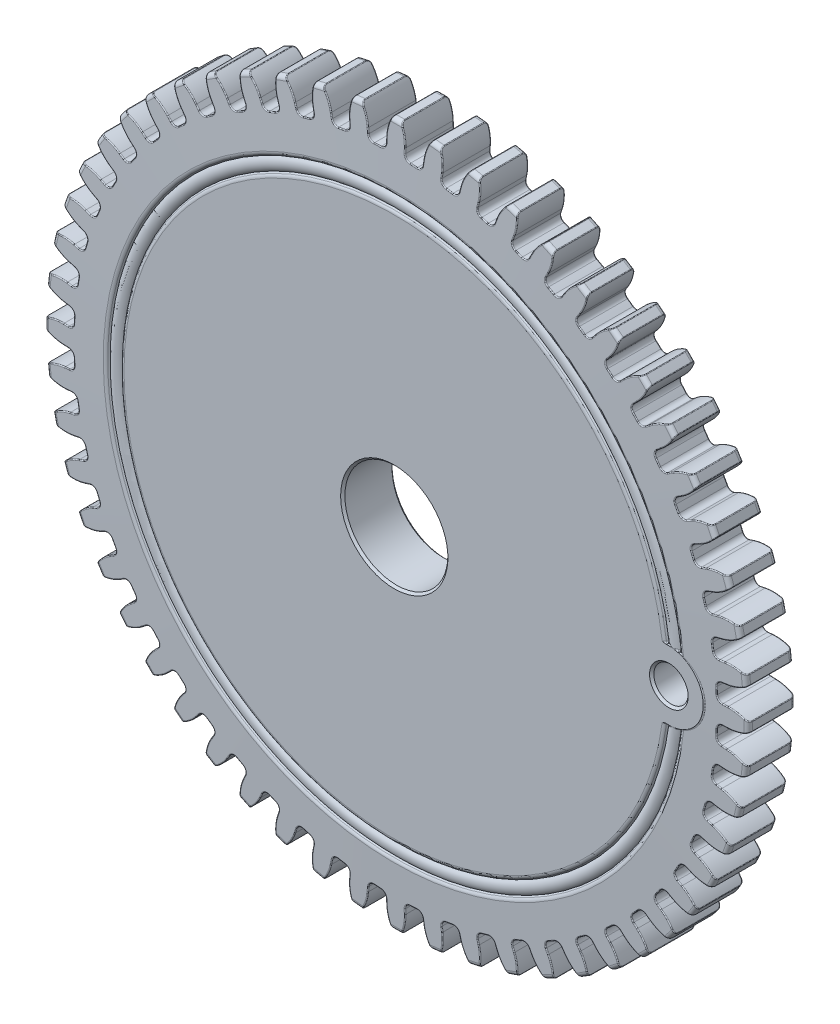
SolidWorks part; units mm, degrees
ref_plane "Спереди" through (0, 0, 0) normal (0, 0, 1) x (1, 0, 0)
ref_plane "Сверху" through (0, 0, 0) normal (0, 1, 0) x (1, 0, 0)
ref_plane "Справа" through (0, 0, 0) normal (1, 0, 0) x (0, 0, -1)
sketch "Эскиз1" plane through (0, 0, 0) normal (1, 0, 0) x (0, 0, -1)
  line L0 (0, 0) -> (8.0775, 0) construction
  line L1 (0, 0) -> (0, 41) construction
  line L2 (3, 6) -> (-3, 6)
  line L3 (-2.75, 41) -> (2.75, 41)
  line L4 (2.7071, 33.4071) -> (3, 33.7)
  line L5 (2.7071, 31.9929) -> (3, 31.7)
  line L6 (3, 6) -> (3, 31.7)
  line L7 (3, 33.7) -> (2.75, 41)
  line L8 (-3, 6) -> (-3, 31.7)
  line L9 (-2.7071, 31.9929) -> (-3, 31.7)
  line L10 (-2.7071, 33.4071) -> (-3, 33.7)
  line L11 (-3, 33.7) -> (-2.75, 41)
  arc A0 (2.7071, 31.9929) -> (2.7071, 33.4071) centre (2, 32.7) ccw
  arc A1 (-2.7071, 31.9929) -> (-2.7071, 33.4071) centre (-2, 32.7) cw
  point P9 (0, 6)
  dimension "D2" = 2
  dimension "D1" = 8.3
  dimension "D3" = 5.5
  dimension "D4" = 41
  dimension "D5" = 90
  dimension "D6" = 6
  dimension "D7" = 12
revolve "Повернуть1" add sketch "Эскиз1" angle 360 about L0
fillet "Скругление1" radius 0.5 4 edges at (41, 0, -2.75) (41, 0, 2.75) (31.7, 0, 3) (33.7, 0, 3)
chamfer "Фаска1" distance 0.25 angle 45 2 edges at (6, 0, 3) (6, 0, -3)
sketch "Эскиз2" plane through (0, 0, 0) normal (0, 0, 1) x (1, 0, 0)
  line L0 (0, 0) -> (0, 41) construction
  line L1 (-1.1, 38.6781) -> (-1.1, 38.0955)
  line L2 (1.1, 38.6781) -> (1.1, 38.0955)
  line L3 (3.2375, 38.5581) -> (3.1723, 37.9791)
  line L4 (5.4237, 38.3118) -> (5.3584, 37.7328)
  line L5 (7.5343, 37.9532) -> (7.4046, 37.3852)
  line L6 (9.6791, 37.4636) -> (9.5495, 36.8956)
  line L7 (11.7363, 36.871) -> (11.5439, 36.321)
  line L8 (13.8129, 36.1444) -> (13.6204, 35.5944)
  line L9 (15.7908, 35.3251) -> (15.538, 34.8001)
  line L10 (17.7729, 34.3705) -> (17.5201, 33.8456)
  line L11 (19.6466, 33.335) -> (19.3366, 32.8416)
  line L12 (21.5094, 32.1645) -> (21.1994, 31.6712)
  line L13 (23.2554, 30.9256) -> (22.8921, 30.4701)
  line L14 (24.9754, 29.554) -> (24.6122, 29.0984)
  line L15 (26.5718, 28.1274) -> (26.1598, 27.7154)
  line L16 (28.1274, 26.5718) -> (27.7154, 26.1598)
  line L17 (29.554, 24.9754) -> (29.0984, 24.6122)
  line L18 (30.9256, 23.2554) -> (30.4701, 22.8921)
  line L19 (32.1645, 21.5094) -> (31.6712, 21.1994)
  line L20 (33.335, 19.6466) -> (32.8416, 19.3366)
  line L21 (34.3705, 17.7729) -> (33.8456, 17.5201)
  line L22 (35.3251, 15.7908) -> (34.8001, 15.538)
  line L23 (36.1444, 13.8129) -> (35.5944, 13.6204)
  line L24 (36.871, 11.7363) -> (36.321, 11.5439)
  line L25 (37.4636, 9.6791) -> (36.8956, 9.5495)
  line L26 (37.9532, 7.5343) -> (37.3852, 7.4046)
  line L27 (38.3118, 5.4237) -> (37.7328, 5.3584)
  line L28 (38.5581, 3.2375) -> (37.9791, 3.1723)
  line L29 (38.6781, 1.1) -> (38.0955, 1.1)
  line L30 (38.6781, -1.1) -> (38.0955, -1.1)
  line L31 (38.5581, -3.2375) -> (37.9791, -3.1723)
  line L32 (38.3118, -5.4237) -> (37.7328, -5.3584)
  line L33 (37.9532, -7.5343) -> (37.3852, -7.4046)
  line L34 (37.4636, -9.6791) -> (36.8956, -9.5495)
  line L35 (36.871, -11.7363) -> (36.321, -11.5439)
  line L36 (36.1444, -13.8129) -> (35.5944, -13.6204)
  line L37 (35.3251, -15.7908) -> (34.8001, -15.538)
  line L38 (34.3705, -17.7729) -> (33.8456, -17.5201)
  line L39 (33.335, -19.6466) -> (32.8416, -19.3366)
  line L40 (32.1645, -21.5094) -> (31.6712, -21.1994)
  line L41 (30.9256, -23.2554) -> (30.4701, -22.8921)
  line L42 (29.554, -24.9754) -> (29.0984, -24.6122)
  line L43 (28.1274, -26.5718) -> (27.7154, -26.1598)
  line L44 (26.5718, -28.1274) -> (26.1598, -27.7154)
  line L45 (24.9754, -29.554) -> (24.6122, -29.0984)
  line L46 (23.2554, -30.9256) -> (22.8921, -30.4701)
  line L47 (21.5094, -32.1645) -> (21.1994, -31.6712)
  line L48 (19.6466, -33.335) -> (19.3366, -32.8416)
  line L49 (17.7729, -34.3705) -> (17.5201, -33.8456)
  line L50 (15.7908, -35.3251) -> (15.538, -34.8001)
  line L51 (13.8129, -36.1444) -> (13.6204, -35.5944)
  line L52 (11.7363, -36.871) -> (11.5439, -36.321)
  line L53 (9.6791, -37.4636) -> (9.5495, -36.8956)
  line L54 (7.5343, -37.9532) -> (7.4046, -37.3852)
  line L55 (5.4237, -38.3118) -> (5.3584, -37.7328)
  line L56 (3.2375, -38.5581) -> (3.1723, -37.9791)
  line L57 (1.1, -38.6781) -> (1.1, -38.0955)
  line L58 (-1.1, -38.6781) -> (-1.1, -38.0955)
  line L59 (-3.2375, -38.5581) -> (-3.1723, -37.9791)
  line L60 (-5.4237, -38.3118) -> (-5.3584, -37.7328)
  line L61 (-7.5343, -37.9532) -> (-7.4046, -37.3852)
  line L62 (-9.6791, -37.4636) -> (-9.5495, -36.8956)
  line L63 (-11.7363, -36.871) -> (-11.5439, -36.321)
  line L64 (-13.8129, -36.1444) -> (-13.6204, -35.5944)
  line L65 (-15.7908, -35.3251) -> (-15.538, -34.8001)
  line L66 (-17.7729, -34.3705) -> (-17.5201, -33.8456)
  line L67 (-19.6466, -33.335) -> (-19.3366, -32.8416)
  line L68 (-21.5094, -32.1645) -> (-21.1994, -31.6712)
  line L69 (-23.2554, -30.9256) -> (-22.8921, -30.4701)
  line L70 (-24.9754, -29.554) -> (-24.6122, -29.0984)
  line L71 (-26.5718, -28.1274) -> (-26.1598, -27.7154)
  line L72 (-28.1274, -26.5718) -> (-27.7154, -26.1598)
  line L73 (-29.554, -24.9754) -> (-29.0984, -24.6122)
  line L74 (-30.9256, -23.2554) -> (-30.4701, -22.8921)
  line L75 (-32.1645, -21.5094) -> (-31.6712, -21.1994)
  line L76 (-33.335, -19.6466) -> (-32.8416, -19.3366)
  line L77 (-34.3705, -17.7729) -> (-33.8456, -17.5201)
  line L78 (-35.3251, -15.7908) -> (-34.8001, -15.538)
  line L79 (-36.1444, -13.8129) -> (-35.5944, -13.6204)
  line L80 (-36.871, -11.7363) -> (-36.321, -11.5439)
  line L81 (-37.4636, -9.6791) -> (-36.8956, -9.5495)
  line L82 (-37.9532, -7.5343) -> (-37.3852, -7.4046)
  line L83 (-38.3118, -5.4237) -> (-37.7328, -5.3584)
  line L84 (-38.5581, -3.2375) -> (-37.9791, -3.1723)
  line L85 (-38.6781, -1.1) -> (-38.0955, -1.1)
  line L86 (-38.6781, 1.1) -> (-38.0955, 1.1)
  line L87 (-38.5581, 3.2375) -> (-37.9791, 3.1723)
  line L88 (-38.3118, 5.4237) -> (-37.7328, 5.3584)
  line L89 (-37.9532, 7.5343) -> (-37.3852, 7.4046)
  line L90 (-37.4636, 9.6791) -> (-36.8956, 9.5495)
  line L91 (-36.871, 11.7363) -> (-36.321, 11.5439)
  line L92 (-36.1444, 13.8129) -> (-35.5944, 13.6204)
  line L93 (-35.3251, 15.7908) -> (-34.8001, 15.538)
  line L94 (-34.3705, 17.7729) -> (-33.8456, 17.5201)
  line L95 (-33.335, 19.6466) -> (-32.8416, 19.3366)
  line L96 (-32.1645, 21.5094) -> (-31.6712, 21.1994)
  line L97 (-30.9256, 23.2554) -> (-30.4701, 22.8921)
  line L98 (-29.554, 24.9754) -> (-29.0984, 24.6122)
  line L99 (-28.1274, 26.5718) -> (-27.7154, 26.1598)
  line L100 (-26.5718, 28.1274) -> (-26.1598, 27.7154)
  line L101 (-24.9754, 29.554) -> (-24.6122, 29.0984)
  line L102 (-23.2554, 30.9256) -> (-22.8921, 30.4701)
  line L103 (-21.5094, 32.1645) -> (-21.1994, 31.6712)
  line L104 (-19.6466, 33.335) -> (-19.3366, 32.8416)
  line L105 (-17.7729, 34.3705) -> (-17.5201, 33.8456)
  line L106 (-15.7908, 35.3251) -> (-15.538, 34.8001)
  line L107 (-13.8129, 36.1444) -> (-13.6204, 35.5944)
  line L108 (-11.7363, 36.871) -> (-11.5439, 36.321)
  line L109 (-9.6791, 37.4636) -> (-9.5495, 36.8956)
  line L110 (-7.5343, 37.9532) -> (-7.4046, 37.3852)
  line L111 (-5.4237, 38.3118) -> (-5.3584, 37.7328)
  line L112 (-3.2375, 38.5581) -> (-3.1723, 37.9791)
  circle A0 centre (0, 0) radius 41 construction
  arc A1 (0.4698, 40.9973) -> (-0.4698, 40.9973) centre (0, 0) ccw
  circle A2 centre (0, 0) radius 38.5 construction
  arc A3 (-1.7061, 37.4612) -> (-2.4989, 37.4166) centre (0, 0) ccw
  arc A4 (-0.5578, 40.9426) -> (-1.1, 38.6781) centre (3.9, 38.6781) ccw
  arc A5 (0.5578, 40.9426) -> (1.1, 38.6781) centre (-3.9, 38.6781) cw
  arc A6 (1.1, 38.0955) -> (1.7061, 37.4612) centre (1.735, 38.0955) ccw
  arc A7 (-1.1, 38.0955) -> (-1.7061, 37.4612) centre (-1.735, 38.0955) cw
  arc A8 (0.5578, 40.9426) -> (0.4698, 40.9973) centre (0.4687, 40.8973) ccw
  arc A9 (-0.5578, 40.9426) -> (-0.4698, 40.9973) centre (-0.4687, 40.8973) cw
  arc A10 (5.0571, 40.6869) -> (4.1234, 40.7921) centre (0, 0) ccw
  arc A11 (4.0298, 40.7476) -> (3.2375, 38.5581) centre (8.2061, 37.9983) ccw
  arc A12 (5.1384, 40.6227) -> (5.4237, 38.3118) centre (0.4551, 38.8716) cw
  arc A13 (3.1723, 37.9791) -> (2.4989, 37.4166) centre (2.5413, 38.0502) cw
  arc A14 (5.3584, 37.7328) -> (5.8897, 37.0346) centre (5.9894, 37.6617) ccw
  arc A15 (4.0298, 40.7476) -> (4.1234, 40.7921) centre (4.1133, 40.6926) cw
  arc A16 (5.1384, 40.6227) -> (5.0571, 40.6869) centre (5.0448, 40.5877) ccw
  arc A17 (9.5808, 39.8649) -> (8.6647, 40.074) centre (0, 0) ccw
  arc A18 (8.5667, 40.0402) -> (7.5343, 37.9532) centre (12.4089, 36.8406) ccw
  arc A19 (9.6544, 39.792) -> (9.6791, 37.4636) centre (4.8045, 38.5762) cw
  arc A20 (7.4046, 37.3852) -> (6.6726, 36.9016) centre (6.7855, 37.5265) cw
  arc A21 (9.5495, 36.8956) -> (9.9992, 36.1423) centre (10.1685, 36.7543) ccw
  arc A22 (8.5667, 40.0402) -> (8.6647, 40.074) centre (8.6436, 39.9762) cw
  arc A23 (9.6544, 39.792) -> (9.5808, 39.8649) centre (9.5574, 39.7676) ccw
  arc A24 (13.984, 38.5415) -> (13.0971, 38.8518) centre (0, 0) ccw
  arc A25 (12.996, 38.8293) -> (11.7363, 36.871) centre (16.4557, 35.2196) ccw
  arc A26 (14.049, 38.4608) -> (13.8129, 36.1444) centre (9.0934, 37.7957) cw
  arc A27 (11.5439, 36.321) -> (10.7623, 35.9225) centre (10.9445, 36.5308) cw
  arc A28 (13.6204, 35.5944) -> (13.983, 34.7955) centre (14.2198, 35.3847) ccw
  arc A29 (12.996, 38.8293) -> (13.0971, 38.8518) centre (13.0652, 38.7571) cw
  arc A30 (14.049, 38.4608) -> (13.984, 38.5415) centre (13.9499, 38.4475) ccw
  arc A31 (18.2114, 36.7335) -> (17.3648, 37.1411) centre (0, 0) ccw
  arc A32 (17.2617, 37.13) -> (15.7908, 35.3251) centre (20.2956, 33.1557) ccw
  arc A33 (18.2669, 36.646) -> (17.7729, 34.3705) centre (13.268, 36.54) cw
  arc A34 (15.538, 34.8001) -> (14.7166, 34.4916) centre (14.9658, 35.0757) cw
  arc A35 (17.5201, 33.8456) -> (17.7909, 33.0111) centre (18.0922, 33.5701) ccw
  arc A36 (17.2617, 37.13) -> (17.3648, 37.1411) centre (17.3224, 37.0506) cw
  arc A37 (18.2669, 36.646) -> (18.2114, 36.7335) centre (18.1669, 36.6439) ccw
  arc A38 (22.2097, 34.4635) -> (21.4141, 34.9634) centre (0, 0) ccw
  arc A39 (21.3105, 34.9639) -> (19.6466, 33.335) centre (23.8802, 30.6748) ccw
  arc A40 (22.2551, 34.3703) -> (21.5094, 32.1645) centre (17.2758, 34.8246) cw
  arc A41 (19.3366, 32.8416) -> (18.4859, 32.627) centre (18.799, 33.1795) cw
  arc A42 (21.1994, 31.6712) -> (21.3751, 30.8116) centre (21.7371, 31.3333) ccw
  arc A43 (21.3105, 34.9639) -> (21.4141, 34.9634) centre (21.3618, 34.8781) cw
  arc A44 (22.2551, 34.3703) -> (22.2097, 34.4635) centre (22.1555, 34.3794) ccw
  arc A45 (25.9287, 31.7601) -> (25.1941, 32.3459) centre (0, 0) ccw
  arc A46 (25.0912, 32.358) -> (23.2554, 30.9256) centre (27.1646, 27.8082) ccw
  arc A47 (25.9634, 31.6624) -> (24.9754, 29.554) centre (21.0663, 32.6714) cw
  arc A48 (22.8921, 30.4701) -> (22.0228, 30.3521) centre (22.3957, 30.866) cw
  arc A49 (24.6122, 29.0984) -> (24.6905, 28.2246) centre (25.1086, 28.7025) ccw
  arc A50 (25.0912, 32.358) -> (25.1941, 32.3459) centre (25.1326, 32.267) cw
  arc A51 (25.9634, 31.6624) -> (25.9287, 31.7601) centre (25.8655, 31.6826) ccw
  arc A52 (29.3217, 28.6573) -> (28.6573, 29.3217) centre (0, 0) ccw
  arc A53 (28.5563, 29.3452) -> (26.5718, 28.1274) centre (30.1073, 24.5919) ccw
  arc A54 (29.3452, 28.5563) -> (28.1274, 26.5718) centre (24.5919, 30.1073) cw
  arc A55 (26.1598, 27.7154) -> (25.2826, 27.6954) centre (25.7108, 28.1644) cw
  arc A56 (27.7154, 26.1598) -> (27.6954, 25.2826) centre (28.1644, 25.7108) ccw
  arc A57 (28.5563, 29.3452) -> (28.6573, 29.3217) centre (28.5874, 29.2502) cw
  arc A58 (29.3452, 28.5563) -> (29.3217, 28.6573) centre (29.2502, 28.5874) ccw
  arc A59 (32.3459, 25.1941) -> (31.7601, 25.9287) centre (0, 0) ccw
  arc A60 (31.6624, 25.9634) -> (29.554, 24.9754) centre (32.6714, 21.0663) ccw
  arc A61 (32.358, 25.0912) -> (30.9256, 23.2554) centre (27.8082, 27.1646) cw
  arc A62 (29.0984, 24.6122) -> (28.2246, 24.6905) centre (28.7025, 25.1086) cw
  arc A63 (30.4701, 22.8921) -> (30.3521, 22.0228) centre (30.866, 22.3957) ccw
  arc A64 (31.6624, 25.9634) -> (31.7601, 25.9287) centre (31.6826, 25.8655) cw
  arc A65 (32.358, 25.0912) -> (32.3459, 25.1941) centre (32.267, 25.1326) ccw
  arc A66 (34.9634, 21.4141) -> (34.4635, 22.2097) centre (0, 0) ccw
  arc A67 (34.3703, 22.2551) -> (32.1645, 21.5094) centre (34.8246, 17.2758) ccw
  arc A68 (34.9639, 21.3105) -> (33.335, 19.6466) centre (30.6748, 23.8802) cw
  arc A69 (31.6712, 21.1994) -> (30.8116, 21.3751) centre (31.3333, 21.7371) cw
  arc A70 (32.8416, 19.3366) -> (32.627, 18.4859) centre (33.1795, 18.799) ccw
  arc A71 (34.3703, 22.2551) -> (34.4635, 22.2097) centre (34.3794, 22.1555) cw
  arc A72 (34.9639, 21.3105) -> (34.9634, 21.4141) centre (34.8781, 21.3618) ccw
  arc A73 (37.1411, 17.3648) -> (36.7335, 18.2114) centre (0, 0) ccw
  arc A74 (36.646, 18.2669) -> (34.3705, 17.7729) centre (36.54, 13.268) ccw
  arc A75 (37.13, 17.2617) -> (35.3251, 15.7908) centre (33.1557, 20.2956) cw
  arc A76 (33.8456, 17.5201) -> (33.0111, 17.7909) centre (33.5701, 18.0922) cw
  arc A77 (34.8001, 15.538) -> (34.4916, 14.7166) centre (35.0757, 14.9658) ccw
  arc A78 (36.646, 18.2669) -> (36.7335, 18.2114) centre (36.6439, 18.1669) cw
  arc A79 (37.13, 17.2617) -> (37.1411, 17.3648) centre (37.0506, 17.3224) ccw
  arc A80 (38.8518, 13.0971) -> (38.5415, 13.984) centre (0, 0) ccw
  arc A81 (38.4608, 14.049) -> (36.1444, 13.8129) centre (37.7957, 9.0934) ccw
  arc A82 (38.8293, 12.996) -> (36.871, 11.7363) centre (35.2196, 16.4557) cw
  arc A83 (35.5944, 13.6204) -> (34.7955, 13.983) centre (35.3847, 14.2198) cw
  arc A84 (36.321, 11.5439) -> (35.9225, 10.7623) centre (36.5308, 10.9445) ccw
  arc A85 (38.4608, 14.049) -> (38.5415, 13.984) centre (38.4475, 13.9499) cw
  arc A86 (38.8293, 12.996) -> (38.8518, 13.0971) centre (38.7571, 13.0652) ccw
  arc A87 (40.074, 8.6647) -> (39.8649, 9.5808) centre (0, 0) ccw
  arc A88 (39.792, 9.6544) -> (37.4636, 9.6791) centre (38.5762, 4.8045) ccw
  arc A89 (40.0402, 8.5667) -> (37.9532, 7.5343) centre (36.8406, 12.4089) cw
  arc A90 (36.8956, 9.5495) -> (36.1423, 9.9992) centre (36.7543, 10.1685) cw
  arc A91 (37.3852, 7.4046) -> (36.9016, 6.6726) centre (37.5265, 6.7855) ccw
  arc A92 (39.792, 9.6544) -> (39.8649, 9.5808) centre (39.7676, 9.5574) cw
  arc A93 (40.0402, 8.5667) -> (40.074, 8.6647) centre (39.9762, 8.6436) ccw
  arc A94 (40.7921, 4.1234) -> (40.6869, 5.0571) centre (0, 0) ccw
  arc A95 (40.6227, 5.1384) -> (38.3118, 5.4237) centre (38.8716, 0.4551) ccw
  arc A96 (40.7476, 4.0298) -> (38.5581, 3.2375) centre (37.9983, 8.2061) cw
  arc A97 (37.7328, 5.3584) -> (37.0346, 5.8897) centre (37.6617, 5.9894) cw
  arc A98 (37.9791, 3.1723) -> (37.4166, 2.4989) centre (38.0502, 2.5413) ccw
  arc A99 (40.6227, 5.1384) -> (40.6869, 5.0571) centre (40.5877, 5.0448) cw
  arc A100 (40.7476, 4.0298) -> (40.7921, 4.1234) centre (40.6926, 4.1133) ccw
  arc A101 (40.9973, -0.4698) -> (40.9973, 0.4698) centre (0, 0) ccw
  arc A102 (40.9426, 0.5578) -> (38.6781, 1.1) centre (38.6781, -3.9) ccw
  arc A103 (40.9426, -0.5578) -> (38.6781, -1.1) centre (38.6781, 3.9) cw
  arc A104 (38.0955, 1.1) -> (37.4612, 1.7061) centre (38.0955, 1.735) cw
  arc A105 (38.0955, -1.1) -> (37.4612, -1.7061) centre (38.0955, -1.735) ccw
  arc A106 (40.9426, 0.5578) -> (40.9973, 0.4698) centre (40.8973, 0.4687) cw
  arc A107 (40.9426, -0.5578) -> (40.9973, -0.4698) centre (40.8973, -0.4687) ccw
  arc A108 (40.6869, -5.0571) -> (40.7921, -4.1234) centre (0, 0) ccw
  arc A109 (40.7476, -4.0298) -> (38.5581, -3.2375) centre (37.9983, -8.2061) ccw
  arc A110 (40.6227, -5.1384) -> (38.3118, -5.4237) centre (38.8716, -0.4551) cw
  arc A111 (37.9791, -3.1723) -> (37.4166, -2.4989) centre (38.0502, -2.5413) cw
  arc A112 (37.7328, -5.3584) -> (37.0346, -5.8897) centre (37.6617, -5.9894) ccw
  arc A113 (40.7476, -4.0298) -> (40.7921, -4.1234) centre (40.6926, -4.1133) cw
  arc A114 (40.6227, -5.1384) -> (40.6869, -5.0571) centre (40.5877, -5.0448) ccw
  arc A115 (39.8649, -9.5808) -> (40.074, -8.6647) centre (0, 0) ccw
  arc A116 (40.0402, -8.5667) -> (37.9532, -7.5343) centre (36.8406, -12.4089) ccw
  arc A117 (39.792, -9.6544) -> (37.4636, -9.6791) centre (38.5762, -4.8045) cw
  arc A118 (37.3852, -7.4046) -> (36.9016, -6.6726) centre (37.5265, -6.7855) cw
  arc A119 (36.8956, -9.5495) -> (36.1423, -9.9992) centre (36.7543, -10.1685) ccw
  arc A120 (40.0402, -8.5667) -> (40.074, -8.6647) centre (39.9762, -8.6436) cw
  arc A121 (39.792, -9.6544) -> (39.8649, -9.5808) centre (39.7676, -9.5574) ccw
  arc A122 (38.5415, -13.984) -> (38.8518, -13.0971) centre (0, 0) ccw
  arc A123 (38.8293, -12.996) -> (36.871, -11.7363) centre (35.2196, -16.4557) ccw
  arc A124 (38.4608, -14.049) -> (36.1444, -13.8129) centre (37.7957, -9.0934) cw
  arc A125 (36.321, -11.5439) -> (35.9225, -10.7623) centre (36.5308, -10.9445) cw
  arc A126 (35.5944, -13.6204) -> (34.7955, -13.983) centre (35.3847, -14.2198) ccw
  arc A127 (38.8293, -12.996) -> (38.8518, -13.0971) centre (38.7571, -13.0652) cw
  arc A128 (38.4608, -14.049) -> (38.5415, -13.984) centre (38.4475, -13.9499) ccw
  arc A129 (36.7335, -18.2114) -> (37.1411, -17.3648) centre (0, 0) ccw
  arc A130 (37.13, -17.2617) -> (35.3251, -15.7908) centre (33.1557, -20.2956) ccw
  arc A131 (36.646, -18.2669) -> (34.3705, -17.7729) centre (36.54, -13.268) cw
  arc A132 (34.8001, -15.538) -> (34.4916, -14.7166) centre (35.0757, -14.9658) cw
  arc A133 (33.8456, -17.5201) -> (33.0111, -17.7909) centre (33.5701, -18.0922) ccw
  arc A134 (37.13, -17.2617) -> (37.1411, -17.3648) centre (37.0506, -17.3224) cw
  arc A135 (36.646, -18.2669) -> (36.7335, -18.2114) centre (36.6439, -18.1669) ccw
  arc A136 (34.4635, -22.2097) -> (34.9634, -21.4141) centre (0, 0) ccw
  arc A137 (34.9639, -21.3105) -> (33.335, -19.6466) centre (30.6748, -23.8802) ccw
  arc A138 (34.3703, -22.2551) -> (32.1645, -21.5094) centre (34.8246, -17.2758) cw
  arc A139 (32.8416, -19.3366) -> (32.627, -18.4859) centre (33.1795, -18.799) cw
  arc A140 (31.6712, -21.1994) -> (30.8116, -21.3751) centre (31.3333, -21.7371) ccw
  arc A141 (34.9639, -21.3105) -> (34.9634, -21.4141) centre (34.8781, -21.3618) cw
  arc A142 (34.3703, -22.2551) -> (34.4635, -22.2097) centre (34.3794, -22.1555) ccw
  arc A143 (31.7601, -25.9287) -> (32.3459, -25.1941) centre (0, 0) ccw
  arc A144 (32.358, -25.0912) -> (30.9256, -23.2554) centre (27.8082, -27.1646) ccw
  arc A145 (31.6624, -25.9634) -> (29.554, -24.9754) centre (32.6714, -21.0663) cw
  arc A146 (30.4701, -22.8921) -> (30.3521, -22.0228) centre (30.866, -22.3957) cw
  arc A147 (29.0984, -24.6122) -> (28.2246, -24.6905) centre (28.7025, -25.1086) ccw
  arc A148 (32.358, -25.0912) -> (32.3459, -25.1941) centre (32.267, -25.1326) cw
  arc A149 (31.6624, -25.9634) -> (31.7601, -25.9287) centre (31.6826, -25.8655) ccw
  arc A150 (28.6573, -29.3217) -> (29.3217, -28.6573) centre (0, 0) ccw
  arc A151 (29.3452, -28.5563) -> (28.1274, -26.5718) centre (24.5919, -30.1073) ccw
  arc A152 (28.5563, -29.3452) -> (26.5718, -28.1274) centre (30.1073, -24.5919) cw
  arc A153 (27.7154, -26.1598) -> (27.6954, -25.2826) centre (28.1644, -25.7108) cw
  arc A154 (26.1598, -27.7154) -> (25.2826, -27.6954) centre (25.7108, -28.1644) ccw
  arc A155 (29.3452, -28.5563) -> (29.3217, -28.6573) centre (29.2502, -28.5874) cw
  arc A156 (28.5563, -29.3452) -> (28.6573, -29.3217) centre (28.5874, -29.2502) ccw
  arc A157 (25.1941, -32.3459) -> (25.9287, -31.7601) centre (0, 0) ccw
  arc A158 (25.9634, -31.6624) -> (24.9754, -29.554) centre (21.0663, -32.6714) ccw
  arc A159 (25.0912, -32.358) -> (23.2554, -30.9256) centre (27.1646, -27.8082) cw
  arc A160 (24.6122, -29.0984) -> (24.6905, -28.2246) centre (25.1086, -28.7025) cw
  arc A161 (22.8921, -30.4701) -> (22.0228, -30.3521) centre (22.3957, -30.866) ccw
  arc A162 (25.9634, -31.6624) -> (25.9287, -31.7601) centre (25.8655, -31.6826) cw
  arc A163 (25.0912, -32.358) -> (25.1941, -32.3459) centre (25.1326, -32.267) ccw
  arc A164 (21.4141, -34.9634) -> (22.2097, -34.4635) centre (0, 0) ccw
  arc A165 (22.2551, -34.3703) -> (21.5094, -32.1645) centre (17.2758, -34.8246) ccw
  arc A166 (21.3105, -34.9639) -> (19.6466, -33.335) centre (23.8802, -30.6748) cw
  arc A167 (21.1994, -31.6712) -> (21.3751, -30.8116) centre (21.7371, -31.3333) cw
  arc A168 (19.3366, -32.8416) -> (18.4859, -32.627) centre (18.799, -33.1795) ccw
  arc A169 (22.2551, -34.3703) -> (22.2097, -34.4635) centre (22.1555, -34.3794) cw
  arc A170 (21.3105, -34.9639) -> (21.4141, -34.9634) centre (21.3618, -34.8781) ccw
  arc A171 (17.3648, -37.1411) -> (18.2114, -36.7335) centre (0, 0) ccw
  arc A172 (18.2669, -36.646) -> (17.7729, -34.3705) centre (13.268, -36.54) ccw
  arc A173 (17.2617, -37.13) -> (15.7908, -35.3251) centre (20.2956, -33.1557) cw
  arc A174 (17.5201, -33.8456) -> (17.7909, -33.0111) centre (18.0922, -33.5701) cw
  arc A175 (15.538, -34.8001) -> (14.7166, -34.4916) centre (14.9658, -35.0757) ccw
  arc A176 (18.2669, -36.646) -> (18.2114, -36.7335) centre (18.1669, -36.6439) cw
  arc A177 (17.2617, -37.13) -> (17.3648, -37.1411) centre (17.3224, -37.0506) ccw
  arc A178 (13.0971, -38.8518) -> (13.984, -38.5415) centre (0, 0) ccw
  arc A179 (14.049, -38.4608) -> (13.8129, -36.1444) centre (9.0934, -37.7957) ccw
  arc A180 (12.996, -38.8293) -> (11.7363, -36.871) centre (16.4557, -35.2196) cw
  arc A181 (13.6204, -35.5944) -> (13.983, -34.7955) centre (14.2198, -35.3847) cw
  arc A182 (11.5439, -36.321) -> (10.7623, -35.9225) centre (10.9445, -36.5308) ccw
  arc A183 (14.049, -38.4608) -> (13.984, -38.5415) centre (13.9499, -38.4475) cw
  arc A184 (12.996, -38.8293) -> (13.0971, -38.8518) centre (13.0652, -38.7571) ccw
  arc A185 (8.6647, -40.074) -> (9.5808, -39.8649) centre (0, 0) ccw
  arc A186 (9.6544, -39.792) -> (9.6791, -37.4636) centre (4.8045, -38.5762) ccw
  arc A187 (8.5667, -40.0402) -> (7.5343, -37.9532) centre (12.4089, -36.8406) cw
  arc A188 (9.5495, -36.8956) -> (9.9992, -36.1423) centre (10.1685, -36.7543) cw
  arc A189 (7.4046, -37.3852) -> (6.6726, -36.9016) centre (6.7855, -37.5265) ccw
  arc A190 (9.6544, -39.792) -> (9.5808, -39.8649) centre (9.5574, -39.7676) cw
  arc A191 (8.5667, -40.0402) -> (8.6647, -40.074) centre (8.6436, -39.9762) ccw
  arc A192 (4.1234, -40.7921) -> (5.0571, -40.6869) centre (0, 0) ccw
  arc A193 (5.1384, -40.6227) -> (5.4237, -38.3118) centre (0.4551, -38.8716) ccw
  arc A194 (4.0298, -40.7476) -> (3.2375, -38.5581) centre (8.2061, -37.9983) cw
  arc A195 (5.3584, -37.7328) -> (5.8897, -37.0346) centre (5.9894, -37.6617) cw
  arc A196 (3.1723, -37.9791) -> (2.4989, -37.4166) centre (2.5413, -38.0502) ccw
  arc A197 (5.1384, -40.6227) -> (5.0571, -40.6869) centre (5.0448, -40.5877) cw
  arc A198 (4.0298, -40.7476) -> (4.1234, -40.7921) centre (4.1133, -40.6926) ccw
  arc A199 (-0.4698, -40.9973) -> (0.4698, -40.9973) centre (0, 0) ccw
  arc A200 (0.5578, -40.9426) -> (1.1, -38.6781) centre (-3.9, -38.6781) ccw
  arc A201 (-0.5578, -40.9426) -> (-1.1, -38.6781) centre (3.9, -38.6781) cw
  arc A202 (1.1, -38.0955) -> (1.7061, -37.4612) centre (1.735, -38.0955) cw
  arc A203 (-1.1, -38.0955) -> (-1.7061, -37.4612) centre (-1.735, -38.0955) ccw
  arc A204 (0.5578, -40.9426) -> (0.4698, -40.9973) centre (0.4687, -40.8973) cw
  arc A205 (-0.5578, -40.9426) -> (-0.4698, -40.9973) centre (-0.4687, -40.8973) ccw
  arc A206 (-5.0571, -40.6869) -> (-4.1234, -40.7921) centre (0, 0) ccw
  arc A207 (-4.0298, -40.7476) -> (-3.2375, -38.5581) centre (-8.2061, -37.9983) ccw
  arc A208 (-5.1384, -40.6227) -> (-5.4237, -38.3118) centre (-0.4551, -38.8716) cw
  arc A209 (-3.1723, -37.9791) -> (-2.4989, -37.4166) centre (-2.5413, -38.0502) cw
  arc A210 (-5.3584, -37.7328) -> (-5.8897, -37.0346) centre (-5.9894, -37.6617) ccw
  arc A211 (-4.0298, -40.7476) -> (-4.1234, -40.7921) centre (-4.1133, -40.6926) cw
  arc A212 (-5.1384, -40.6227) -> (-5.0571, -40.6869) centre (-5.0448, -40.5877) ccw
  arc A213 (-9.5808, -39.8649) -> (-8.6647, -40.074) centre (0, 0) ccw
  arc A214 (-8.5667, -40.0402) -> (-7.5343, -37.9532) centre (-12.4089, -36.8406) ccw
  arc A215 (-9.6544, -39.792) -> (-9.6791, -37.4636) centre (-4.8045, -38.5762) cw
  arc A216 (-7.4046, -37.3852) -> (-6.6726, -36.9016) centre (-6.7855, -37.5265) cw
  arc A217 (-9.5495, -36.8956) -> (-9.9992, -36.1423) centre (-10.1685, -36.7543) ccw
  arc A218 (-8.5667, -40.0402) -> (-8.6647, -40.074) centre (-8.6436, -39.9762) cw
  arc A219 (-9.6544, -39.792) -> (-9.5808, -39.8649) centre (-9.5574, -39.7676) ccw
  arc A220 (-13.984, -38.5415) -> (-13.0971, -38.8518) centre (0, 0) ccw
  arc A221 (-12.996, -38.8293) -> (-11.7363, -36.871) centre (-16.4557, -35.2196) ccw
  arc A222 (-14.049, -38.4608) -> (-13.8129, -36.1444) centre (-9.0934, -37.7957) cw
  arc A223 (-11.5439, -36.321) -> (-10.7623, -35.9225) centre (-10.9445, -36.5308) cw
  arc A224 (-13.6204, -35.5944) -> (-13.983, -34.7955) centre (-14.2198, -35.3847) ccw
  arc A225 (-12.996, -38.8293) -> (-13.0971, -38.8518) centre (-13.0652, -38.7571) cw
  arc A226 (-14.049, -38.4608) -> (-13.984, -38.5415) centre (-13.9499, -38.4475) ccw
  arc A227 (-18.2114, -36.7335) -> (-17.3648, -37.1411) centre (0, 0) ccw
  arc A228 (-17.2617, -37.13) -> (-15.7908, -35.3251) centre (-20.2956, -33.1557) ccw
  arc A229 (-18.2669, -36.646) -> (-17.7729, -34.3705) centre (-13.268, -36.54) cw
  arc A230 (-15.538, -34.8001) -> (-14.7166, -34.4916) centre (-14.9658, -35.0757) cw
  arc A231 (-17.5201, -33.8456) -> (-17.7909, -33.0111) centre (-18.0922, -33.5701) ccw
  arc A232 (-17.2617, -37.13) -> (-17.3648, -37.1411) centre (-17.3224, -37.0506) cw
  arc A233 (-18.2669, -36.646) -> (-18.2114, -36.7335) centre (-18.1669, -36.6439) ccw
  arc A234 (-22.2097, -34.4635) -> (-21.4141, -34.9634) centre (0, 0) ccw
  arc A235 (-21.3105, -34.9639) -> (-19.6466, -33.335) centre (-23.8802, -30.6748) ccw
  arc A236 (-22.2551, -34.3703) -> (-21.5094, -32.1645) centre (-17.2758, -34.8246) cw
  arc A237 (-19.3366, -32.8416) -> (-18.4859, -32.627) centre (-18.799, -33.1795) cw
  arc A238 (-21.1994, -31.6712) -> (-21.3751, -30.8116) centre (-21.7371, -31.3333) ccw
  arc A239 (-21.3105, -34.9639) -> (-21.4141, -34.9634) centre (-21.3618, -34.8781) cw
  arc A240 (-22.2551, -34.3703) -> (-22.2097, -34.4635) centre (-22.1555, -34.3794) ccw
  arc A241 (-25.9287, -31.7601) -> (-25.1941, -32.3459) centre (0, 0) ccw
  arc A242 (-25.0912, -32.358) -> (-23.2554, -30.9256) centre (-27.1646, -27.8082) ccw
  arc A243 (-25.9634, -31.6624) -> (-24.9754, -29.554) centre (-21.0663, -32.6714) cw
  arc A244 (-22.8921, -30.4701) -> (-22.0228, -30.3521) centre (-22.3957, -30.866) cw
  arc A245 (-24.6122, -29.0984) -> (-24.6905, -28.2246) centre (-25.1086, -28.7025) ccw
  arc A246 (-25.0912, -32.358) -> (-25.1941, -32.3459) centre (-25.1326, -32.267) cw
  arc A247 (-25.9634, -31.6624) -> (-25.9287, -31.7601) centre (-25.8655, -31.6826) ccw
  arc A248 (-29.3217, -28.6573) -> (-28.6573, -29.3217) centre (0, 0) ccw
  arc A249 (-28.5563, -29.3452) -> (-26.5718, -28.1274) centre (-30.1073, -24.5919) ccw
  arc A250 (-29.3452, -28.5563) -> (-28.1274, -26.5718) centre (-24.5919, -30.1073) cw
  arc A251 (-26.1598, -27.7154) -> (-25.2826, -27.6954) centre (-25.7108, -28.1644) cw
  arc A252 (-27.7154, -26.1598) -> (-27.6954, -25.2826) centre (-28.1644, -25.7108) ccw
  arc A253 (-28.5563, -29.3452) -> (-28.6573, -29.3217) centre (-28.5874, -29.2502) cw
  arc A254 (-29.3452, -28.5563) -> (-29.3217, -28.6573) centre (-29.2502, -28.5874) ccw
  arc A255 (-32.3459, -25.1941) -> (-31.7601, -25.9287) centre (0, 0) ccw
  arc A256 (-31.6624, -25.9634) -> (-29.554, -24.9754) centre (-32.6714, -21.0663) ccw
  arc A257 (-32.358, -25.0912) -> (-30.9256, -23.2554) centre (-27.8082, -27.1646) cw
  arc A258 (-29.0984, -24.6122) -> (-28.2246, -24.6905) centre (-28.7025, -25.1086) cw
  arc A259 (-30.4701, -22.8921) -> (-30.3521, -22.0228) centre (-30.866, -22.3957) ccw
  arc A260 (-31.6624, -25.9634) -> (-31.7601, -25.9287) centre (-31.6826, -25.8655) cw
  arc A261 (-32.358, -25.0912) -> (-32.3459, -25.1941) centre (-32.267, -25.1326) ccw
  arc A262 (-34.9634, -21.4141) -> (-34.4635, -22.2097) centre (0, 0) ccw
  arc A263 (-34.3703, -22.2551) -> (-32.1645, -21.5094) centre (-34.8246, -17.2758) ccw
  arc A264 (-34.9639, -21.3105) -> (-33.335, -19.6466) centre (-30.6748, -23.8802) cw
  arc A265 (-31.6712, -21.1994) -> (-30.8116, -21.3751) centre (-31.3333, -21.7371) cw
  arc A266 (-32.8416, -19.3366) -> (-32.627, -18.4859) centre (-33.1795, -18.799) ccw
  arc A267 (-34.3703, -22.2551) -> (-34.4635, -22.2097) centre (-34.3794, -22.1555) cw
  arc A268 (-34.9639, -21.3105) -> (-34.9634, -21.4141) centre (-34.8781, -21.3618) ccw
  arc A269 (-37.1411, -17.3648) -> (-36.7335, -18.2114) centre (0, 0) ccw
  arc A270 (-36.646, -18.2669) -> (-34.3705, -17.7729) centre (-36.54, -13.268) ccw
  arc A271 (-37.13, -17.2617) -> (-35.3251, -15.7908) centre (-33.1557, -20.2956) cw
  arc A272 (-33.8456, -17.5201) -> (-33.0111, -17.7909) centre (-33.5701, -18.0922) cw
  arc A273 (-34.8001, -15.538) -> (-34.4916, -14.7166) centre (-35.0757, -14.9658) ccw
  arc A274 (-36.646, -18.2669) -> (-36.7335, -18.2114) centre (-36.6439, -18.1669) cw
  arc A275 (-37.13, -17.2617) -> (-37.1411, -17.3648) centre (-37.0506, -17.3224) ccw
  arc A276 (-38.8518, -13.0971) -> (-38.5415, -13.984) centre (0, 0) ccw
  arc A277 (-38.4608, -14.049) -> (-36.1444, -13.8129) centre (-37.7957, -9.0934) ccw
  arc A278 (-38.8293, -12.996) -> (-36.871, -11.7363) centre (-35.2196, -16.4557) cw
  arc A279 (-35.5944, -13.6204) -> (-34.7955, -13.983) centre (-35.3847, -14.2198) cw
  arc A280 (-36.321, -11.5439) -> (-35.9225, -10.7623) centre (-36.5308, -10.9445) ccw
  arc A281 (-38.4608, -14.049) -> (-38.5415, -13.984) centre (-38.4475, -13.9499) cw
  arc A282 (-38.8293, -12.996) -> (-38.8518, -13.0971) centre (-38.7571, -13.0652) ccw
  arc A283 (-40.074, -8.6647) -> (-39.8649, -9.5808) centre (0, 0) ccw
  arc A284 (-39.792, -9.6544) -> (-37.4636, -9.6791) centre (-38.5762, -4.8045) ccw
  arc A285 (-40.0402, -8.5667) -> (-37.9532, -7.5343) centre (-36.8406, -12.4089) cw
  arc A286 (-36.8956, -9.5495) -> (-36.1423, -9.9992) centre (-36.7543, -10.1685) cw
  arc A287 (-37.3852, -7.4046) -> (-36.9016, -6.6726) centre (-37.5265, -6.7855) ccw
  arc A288 (-39.792, -9.6544) -> (-39.8649, -9.5808) centre (-39.7676, -9.5574) cw
  arc A289 (-40.0402, -8.5667) -> (-40.074, -8.6647) centre (-39.9762, -8.6436) ccw
  arc A290 (-40.7921, -4.1234) -> (-40.6869, -5.0571) centre (0, 0) ccw
  arc A291 (-40.6227, -5.1384) -> (-38.3118, -5.4237) centre (-38.8716, -0.4551) ccw
  arc A292 (-40.7476, -4.0298) -> (-38.5581, -3.2375) centre (-37.9983, -8.2061) cw
  arc A293 (-37.7328, -5.3584) -> (-37.0346, -5.8897) centre (-37.6617, -5.9894) cw
  arc A294 (-37.9791, -3.1723) -> (-37.4166, -2.4989) centre (-38.0502, -2.5413) ccw
  arc A295 (-40.6227, -5.1384) -> (-40.6869, -5.0571) centre (-40.5877, -5.0448) cw
  arc A296 (-40.7476, -4.0298) -> (-40.7921, -4.1234) centre (-40.6926, -4.1133) ccw
  arc A297 (-40.9973, 0.4698) -> (-40.9973, -0.4698) centre (0, 0) ccw
  arc A298 (-40.9426, -0.5578) -> (-38.6781, -1.1) centre (-38.6781, 3.9) ccw
  arc A299 (-40.9426, 0.5578) -> (-38.6781, 1.1) centre (-38.6781, -3.9) cw
  arc A300 (-38.0955, -1.1) -> (-37.4612, -1.7061) centre (-38.0955, -1.735) cw
  arc A301 (-38.0955, 1.1) -> (-37.4612, 1.7061) centre (-38.0955, 1.735) ccw
  arc A302 (-40.9426, -0.5578) -> (-40.9973, -0.4698) centre (-40.8973, -0.4687) cw
  arc A303 (-40.9426, 0.5578) -> (-40.9973, 0.4698) centre (-40.8973, 0.4687) ccw
  arc A304 (-40.6869, 5.0571) -> (-40.7921, 4.1234) centre (0, 0) ccw
  arc A305 (-40.7476, 4.0298) -> (-38.5581, 3.2375) centre (-37.9983, 8.2061) ccw
  arc A306 (-40.6227, 5.1384) -> (-38.3118, 5.4237) centre (-38.8716, 0.4551) cw
  arc A307 (-37.9791, 3.1723) -> (-37.4166, 2.4989) centre (-38.0502, 2.5413) cw
  arc A308 (-37.7328, 5.3584) -> (-37.0346, 5.8897) centre (-37.6617, 5.9894) ccw
  arc A309 (-40.7476, 4.0298) -> (-40.7921, 4.1234) centre (-40.6926, 4.1133) cw
  arc A310 (-40.6227, 5.1384) -> (-40.6869, 5.0571) centre (-40.5877, 5.0448) ccw
  arc A311 (-39.8649, 9.5808) -> (-40.074, 8.6647) centre (0, 0) ccw
  arc A312 (-40.0402, 8.5667) -> (-37.9532, 7.5343) centre (-36.8406, 12.4089) ccw
  arc A313 (-39.792, 9.6544) -> (-37.4636, 9.6791) centre (-38.5762, 4.8045) cw
  arc A314 (-37.3852, 7.4046) -> (-36.9016, 6.6726) centre (-37.5265, 6.7855) cw
  arc A315 (-36.8956, 9.5495) -> (-36.1423, 9.9992) centre (-36.7543, 10.1685) ccw
  arc A316 (-40.0402, 8.5667) -> (-40.074, 8.6647) centre (-39.9762, 8.6436) cw
  arc A317 (-39.792, 9.6544) -> (-39.8649, 9.5808) centre (-39.7676, 9.5574) ccw
  arc A318 (-38.5415, 13.984) -> (-38.8518, 13.0971) centre (0, 0) ccw
  arc A319 (-38.8293, 12.996) -> (-36.871, 11.7363) centre (-35.2196, 16.4557) ccw
  arc A320 (-38.4608, 14.049) -> (-36.1444, 13.8129) centre (-37.7957, 9.0934) cw
  arc A321 (-36.321, 11.5439) -> (-35.9225, 10.7623) centre (-36.5308, 10.9445) cw
  arc A322 (-35.5944, 13.6204) -> (-34.7955, 13.983) centre (-35.3847, 14.2198) ccw
  arc A323 (-38.8293, 12.996) -> (-38.8518, 13.0971) centre (-38.7571, 13.0652) cw
  arc A324 (-38.4608, 14.049) -> (-38.5415, 13.984) centre (-38.4475, 13.9499) ccw
  arc A325 (-36.7335, 18.2114) -> (-37.1411, 17.3648) centre (0, 0) ccw
  arc A326 (-37.13, 17.2617) -> (-35.3251, 15.7908) centre (-33.1557, 20.2956) ccw
  arc A327 (-36.646, 18.2669) -> (-34.3705, 17.7729) centre (-36.54, 13.268) cw
  arc A328 (-34.8001, 15.538) -> (-34.4916, 14.7166) centre (-35.0757, 14.9658) cw
  arc A329 (-33.8456, 17.5201) -> (-33.0111, 17.7909) centre (-33.5701, 18.0922) ccw
  arc A330 (-37.13, 17.2617) -> (-37.1411, 17.3648) centre (-37.0506, 17.3224) cw
  arc A331 (-36.646, 18.2669) -> (-36.7335, 18.2114) centre (-36.6439, 18.1669) ccw
  arc A332 (-34.4635, 22.2097) -> (-34.9634, 21.4141) centre (0, 0) ccw
  arc A333 (-34.9639, 21.3105) -> (-33.335, 19.6466) centre (-30.6748, 23.8802) ccw
  arc A334 (-34.3703, 22.2551) -> (-32.1645, 21.5094) centre (-34.8246, 17.2758) cw
  arc A335 (-32.8416, 19.3366) -> (-32.627, 18.4859) centre (-33.1795, 18.799) cw
  arc A336 (-31.6712, 21.1994) -> (-30.8116, 21.3751) centre (-31.3333, 21.7371) ccw
  arc A337 (-34.9639, 21.3105) -> (-34.9634, 21.4141) centre (-34.8781, 21.3618) cw
  arc A338 (-34.3703, 22.2551) -> (-34.4635, 22.2097) centre (-34.3794, 22.1555) ccw
  arc A339 (-5.8897, 37.0346) -> (-6.6726, 36.9016) centre (0, 0) ccw
  arc A340 (2.4989, 37.4166) -> (1.7061, 37.4612) centre (0, 0) ccw
  arc A341 (-9.9992, 36.1423) -> (-10.7623, 35.9225) centre (0, 0) ccw
  arc A342 (6.6726, 36.9016) -> (5.8897, 37.0346) centre (0, 0) ccw
  arc A343 (10.7623, 35.9225) -> (9.9992, 36.1423) centre (0, 0) ccw
  arc A344 (-13.983, 34.7955) -> (-14.7166, 34.4916) centre (0, 0) ccw
  arc A345 (-17.7909, 33.0111) -> (-18.4859, 32.627) centre (0, 0) ccw
  arc A346 (-21.3751, 30.8116) -> (-22.0228, 30.3521) centre (0, 0) ccw
  arc A347 (18.4859, 32.627) -> (17.7909, 33.0111) centre (0, 0) ccw
  arc A348 (22.0228, 30.3521) -> (21.3751, 30.8116) centre (0, 0) ccw
  arc A349 (-27.6954, 25.2826) -> (-28.2246, 24.6905) centre (0, 0) ccw
  arc A350 (-30.3521, 22.0228) -> (-30.8116, 21.3751) centre (0, 0) ccw
  arc A351 (-32.627, 18.4859) -> (-33.0111, 17.7909) centre (0, 0) ccw
  arc A352 (-34.4916, 14.7166) -> (-34.7955, 13.983) centre (0, 0) ccw
  arc A353 (-35.9225, 10.7623) -> (-36.1423, 9.9992) centre (0, 0) ccw
  arc A354 (25.2826, 27.6954) -> (24.6905, 28.2246) centre (0, 0) ccw
  arc A355 (28.2246, 24.6905) -> (27.6954, 25.2826) centre (0, 0) ccw
  arc A356 (30.8116, 21.3751) -> (30.3521, 22.0228) centre (0, 0) ccw
  arc A357 (33.0111, 17.7909) -> (32.627, 18.4859) centre (0, 0) ccw
  arc A358 (36.1423, 9.9992) -> (35.9225, 10.7623) centre (0, 0) ccw
  arc A359 (37.0346, 5.8897) -> (36.9016, 6.6726) centre (0, 0) ccw
  arc A360 (-37.4166, 2.4989) -> (-37.4612, 1.7061) centre (0, 0) ccw
  arc A361 (-37.4612, -1.7061) -> (-37.4166, -2.4989) centre (0, 0) ccw
  arc A362 (-37.0346, -5.8897) -> (-36.9016, -6.6726) centre (0, 0) ccw
  arc A363 (-36.1423, -9.9992) -> (-35.9225, -10.7623) centre (0, 0) ccw
  arc A364 (-34.7955, -13.983) -> (-34.4916, -14.7166) centre (0, 0) ccw
  arc A365 (37.4612, 1.7061) -> (37.4166, 2.4989) centre (0, 0) ccw
  arc A366 (37.4166, -2.4989) -> (37.4612, -1.7061) centre (0, 0) ccw
  arc A367 (36.9016, -6.6726) -> (37.0346, -5.8897) centre (0, 0) ccw
  arc A368 (35.9225, -10.7623) -> (36.1423, -9.9992) centre (0, 0) ccw
  arc A369 (32.627, -18.4859) -> (33.0111, -17.7909) centre (0, 0) ccw
  arc A370 (30.3521, -22.0228) -> (30.8116, -21.3751) centre (0, 0) ccw
  arc A371 (27.6954, -25.2826) -> (28.2246, -24.6905) centre (0, 0) ccw
  arc A372 (24.6905, -28.2246) -> (25.2826, -27.6954) centre (0, 0) ccw
  arc A373 (21.3751, -30.8116) -> (22.0228, -30.3521) centre (0, 0) ccw
  arc A374 (13.983, -34.7955) -> (14.7166, -34.4916) centre (0, 0) ccw
  arc A375 (9.9992, -36.1423) -> (10.7623, -35.9225) centre (0, 0) ccw
  arc A376 (5.8897, -37.0346) -> (6.6726, -36.9016) centre (0, 0) ccw
  arc A377 (1.7061, -37.4612) -> (2.4989, -37.4166) centre (0, 0) ccw
  arc A378 (-2.4989, -37.4166) -> (-1.7061, -37.4612) centre (0, 0) ccw
  arc A379 (-22.0228, -30.3521) -> (-21.3751, -30.8116) centre (0, 0) ccw
  arc A380 (-18.4859, -32.627) -> (-17.7909, -33.0111) centre (0, 0) ccw
  arc A381 (-14.7166, -34.4916) -> (-13.983, -34.7955) centre (0, 0) ccw
  arc A382 (-6.6726, -36.9016) -> (-5.8897, -37.0346) centre (0, 0) ccw
  arc A383 (-25.2826, -27.6954) -> (-24.6905, -28.2246) centre (0, 0) ccw
  arc A384 (-28.2246, -24.6905) -> (-27.6954, -25.2826) centre (0, 0) ccw
  arc A385 (-33.0111, -17.7909) -> (-32.627, -18.4859) centre (0, 0) ccw
  arc A386 (-31.7601, 25.9287) -> (-32.3459, 25.1941) centre (0, 0) ccw
  arc A387 (-32.358, 25.0912) -> (-30.9256, 23.2554) centre (-27.8082, 27.1646) ccw
  arc A388 (-31.6624, 25.9634) -> (-29.554, 24.9754) centre (-32.6714, 21.0663) cw
  arc A389 (-30.4701, 22.8921) -> (-30.3521, 22.0228) centre (-30.866, 22.3957) cw
  arc A390 (-29.0984, 24.6122) -> (-28.2246, 24.6905) centre (-28.7025, 25.1086) ccw
  arc A391 (-32.358, 25.0912) -> (-32.3459, 25.1941) centre (-32.267, 25.1326) cw
  arc A392 (-31.6624, 25.9634) -> (-31.7601, 25.9287) centre (-31.6826, 25.8655) ccw
  arc A393 (-28.6573, 29.3217) -> (-29.3217, 28.6573) centre (0, 0) ccw
  arc A394 (-29.3452, 28.5563) -> (-28.1274, 26.5718) centre (-24.5919, 30.1073) ccw
  arc A395 (-28.5563, 29.3452) -> (-26.5718, 28.1274) centre (-30.1073, 24.5919) cw
  arc A396 (-27.7154, 26.1598) -> (-27.6954, 25.2826) centre (-28.1644, 25.7108) cw
  arc A397 (-26.1598, 27.7154) -> (-25.2826, 27.6954) centre (-25.7108, 28.1644) ccw
  arc A398 (-29.3452, 28.5563) -> (-29.3217, 28.6573) centre (-29.2502, 28.5874) cw
  arc A399 (-28.5563, 29.3452) -> (-28.6573, 29.3217) centre (-28.5874, 29.2502) ccw
  arc A400 (-25.1941, 32.3459) -> (-25.9287, 31.7601) centre (0, 0) ccw
  arc A401 (-25.9634, 31.6624) -> (-24.9754, 29.554) centre (-21.0663, 32.6714) ccw
  arc A402 (-25.0912, 32.358) -> (-23.2554, 30.9256) centre (-27.1646, 27.8082) cw
  arc A403 (-24.6122, 29.0984) -> (-24.6905, 28.2246) centre (-25.1086, 28.7025) cw
  arc A404 (-22.8921, 30.4701) -> (-22.0228, 30.3521) centre (-22.3957, 30.866) ccw
  arc A405 (-25.9634, 31.6624) -> (-25.9287, 31.7601) centre (-25.8655, 31.6826) cw
  arc A406 (-25.0912, 32.358) -> (-25.1941, 32.3459) centre (-25.1326, 32.267) ccw
  arc A407 (-21.4141, 34.9634) -> (-22.2097, 34.4635) centre (0, 0) ccw
  arc A408 (-22.2551, 34.3703) -> (-21.5094, 32.1645) centre (-17.2758, 34.8246) ccw
  arc A409 (-21.3105, 34.9639) -> (-19.6466, 33.335) centre (-23.8802, 30.6748) cw
  arc A410 (-21.1994, 31.6712) -> (-21.3751, 30.8116) centre (-21.7371, 31.3333) cw
  arc A411 (-19.3366, 32.8416) -> (-18.4859, 32.627) centre (-18.799, 33.1795) ccw
  arc A412 (-22.2551, 34.3703) -> (-22.2097, 34.4635) centre (-22.1555, 34.3794) cw
  arc A413 (-21.3105, 34.9639) -> (-21.4141, 34.9634) centre (-21.3618, 34.8781) ccw
  arc A414 (-17.3648, 37.1411) -> (-18.2114, 36.7335) centre (0, 0) ccw
  arc A415 (-18.2669, 36.646) -> (-17.7729, 34.3705) centre (-13.268, 36.54) ccw
  arc A416 (-17.2617, 37.13) -> (-15.7908, 35.3251) centre (-20.2956, 33.1557) cw
  arc A417 (-17.5201, 33.8456) -> (-17.7909, 33.0111) centre (-18.0922, 33.5701) cw
  arc A418 (-15.538, 34.8001) -> (-14.7166, 34.4916) centre (-14.9658, 35.0757) ccw
  arc A419 (-18.2669, 36.646) -> (-18.2114, 36.7335) centre (-18.1669, 36.6439) cw
  arc A420 (-17.2617, 37.13) -> (-17.3648, 37.1411) centre (-17.3224, 37.0506) ccw
  arc A421 (-13.0971, 38.8518) -> (-13.984, 38.5415) centre (0, 0) ccw
  arc A422 (-14.049, 38.4608) -> (-13.8129, 36.1444) centre (-9.0934, 37.7957) ccw
  arc A423 (-12.996, 38.8293) -> (-11.7363, 36.871) centre (-16.4557, 35.2196) cw
  arc A424 (-13.6204, 35.5944) -> (-13.983, 34.7955) centre (-14.2198, 35.3847) cw
  arc A425 (-11.5439, 36.321) -> (-10.7623, 35.9225) centre (-10.9445, 36.5308) ccw
  arc A426 (-14.049, 38.4608) -> (-13.984, 38.5415) centre (-13.9499, 38.4475) cw
  arc A427 (-12.996, 38.8293) -> (-13.0971, 38.8518) centre (-13.0652, 38.7571) ccw
  arc A428 (-8.6647, 40.074) -> (-9.5808, 39.8649) centre (0, 0) ccw
  arc A429 (-9.6544, 39.792) -> (-9.6791, 37.4636) centre (-4.8045, 38.5762) ccw
  arc A430 (-8.5667, 40.0402) -> (-7.5343, 37.9532) centre (-12.4089, 36.8406) cw
  arc A431 (-9.5495, 36.8956) -> (-9.9992, 36.1423) centre (-10.1685, 36.7543) cw
  arc A432 (-7.4046, 37.3852) -> (-6.6726, 36.9016) centre (-6.7855, 37.5265) ccw
  arc A433 (-9.6544, 39.792) -> (-9.5808, 39.8649) centre (-9.5574, 39.7676) cw
  arc A434 (-8.5667, 40.0402) -> (-8.6647, 40.074) centre (-8.6436, 39.9762) ccw
  arc A435 (-4.1234, 40.7921) -> (-5.0571, 40.6869) centre (0, 0) ccw
  arc A436 (-5.1384, 40.6227) -> (-5.4237, 38.3118) centre (-0.4551, 38.8716) ccw
  arc A437 (-4.0298, 40.7476) -> (-3.2375, 38.5581) centre (-8.2061, 37.9983) cw
  arc A438 (-5.3584, 37.7328) -> (-5.8897, 37.0346) centre (-5.9894, 37.6617) cw
  arc A439 (-3.1723, 37.9791) -> (-2.4989, 37.4166) centre (-2.5413, 38.0502) ccw
  arc A440 (-5.1384, 40.6227) -> (-5.0571, 40.6869) centre (-5.0448, 40.5877) cw
  arc A441 (-4.0298, 40.7476) -> (-4.1234, 40.7921) centre (-4.1133, 40.6926) ccw
  arc A442 (-24.6905, 28.2246) -> (-25.2826, 27.6954) centre (0, 0) ccw
  arc A443 (-36.9016, 6.6726) -> (-37.0346, 5.8897) centre (0, 0) ccw
  arc A444 (-30.8116, -21.3751) -> (-30.3521, -22.0228) centre (0, 0) ccw
  arc A445 (-10.7623, -35.9225) -> (-9.9992, -36.1423) centre (0, 0) ccw
  arc A446 (17.7909, -33.0111) -> (18.4859, -32.627) centre (0, 0) ccw
  arc A447 (34.4916, -14.7166) -> (34.7955, -13.983) centre (0, 0) ccw
  arc A448 (14.7166, 34.4916) -> (13.983, 34.7955) centre (0, 0) ccw
  arc A449 (34.7955, 13.983) -> (34.4916, 14.7166) centre (0, 0) ccw
  point P14 (1.1, 37.4839)
  point P17 (-1.1, 37.4839)
  point P20 (0.53, 40.9966)
  point P23 (-0.53, 40.9966)
  dimension "D1" = 77
  dimension "D2" = 75
  dimension "D4" = 10
  dimension "D6" = 0.635
  dimension "D7" = 0.635
  dimension "D8" = 0.1
  dimension "D9" = 0.1
  dimension "D3" = 2.2
  dimension "D5" = 1.06
  dimension "D10" = 56
extrude "Вырез-Вытянуть1" cut sketch "Эскиз2" against normal mid plane 10 flip side to cut
fillet "Скругление2" radius 0.1 616 edges at (0.681, 40.6819, 2.7303) (0.5098, 40.9885, 2.358) (-0.5451, 40.9618, 2.4495) (-0.671, 40.7044, 2.7206) (-3.8783, 40.5023, 2.7303) (-4.0826, 40.7878, 2.358) (-5.1279, 40.6432, 2.4495) (-5.2243, 40.3733, 2.7207) (-8.3887, 39.8134, 2.7303) (-8.6237, 40.0742, 2.3581) (-9.6463, 39.8135, 2.4495) (-9.7118, 39.5345, 2.7207) (-12.7936, 38.6238, 2.7303) (-13.0563, 38.8567, 2.3582) (-14.0433, 38.4831, 2.4495) (-14.0772, 38.1985, 2.7207) (-17.0377, 36.9485, 2.7303) (-17.3248, 37.1505, 2.3581) (-18.2638, 36.6688, 2.4495) (-18.2656, 36.3822, 2.7207) (-21.0675, 34.8086, 2.7303) (-21.3755, 34.9772, 2.358) (-22.2545, 34.3933, 2.4495) (-22.2242, 34.1083, 2.7207) (-24.8323, 32.2309, 2.7303) (-25.1573, 32.3639, 2.358) (-25.9654, 31.6854, 2.4495) (-25.9034, 31.4055, 2.7207) (-28.2849, 29.2479, 2.7303) (-28.6227, 29.3437, 2.3579) (-29.3498, 28.5789, 2.4495) (-29.2568, 28.3078, 2.7207) (-31.3818, 25.8971, 2.7303) (-31.7282, 25.9545, 2.3579) (-32.3651, 25.1131, 2.4495) (-32.2423, 24.8541, 2.7206) (-34.084, 22.2206, 2.7303) (-34.4347, 22.2388, 2.3579) (-34.9734, 21.3315, 2.4495) (-34.8224, 21.0879, 2.7206) (-36.3576, 18.2647, 2.7303) (-36.7081, 18.2435, 2.3579) (-37.1418, 17.2816, 2.4495) (-36.9646, 17.0564, 2.7206) (-38.174, 14.0791, 2.7303) (-38.5199, 14.0188, 2.3579) (-38.8432, 13.0143, 2.4495) (-38.7502, 12.9152, 2.628) (-39.5104, 9.7164, 2.7303) (-39.8473, 9.6178, 2.3579) (-40.0561, 8.5834, 2.4495) (-39.8332, 8.4034, 2.7206) (-40.3498, 5.2316, 2.7303) (-40.6736, 5.0959, 2.358) (-40.7653, 4.0446, 2.4495) (-40.5236, 3.8906, 2.7206) (-40.6819, 0.681, 2.7303) (-40.9885, 0.5098, 2.358) (-40.9618, -0.5451, 2.4495) (-40.7044, -0.671, 2.7206) (-40.5023, -3.8783, 2.7303) (-40.7878, -4.0826, 2.358) (-40.6432, -5.1279, 2.4495) (-40.3733, -5.2243, 2.7207) (-39.8134, -8.3887, 2.7303) (-40.0742, -8.6237, 2.3581) (-39.8135, -9.6463, 2.4495) (-39.5345, -9.7118, 2.7207) (-38.6238, -12.7936, 2.7303) (-38.8567, -13.0563, 2.3581) (-38.4831, -14.0433, 2.4495) (-38.1985, -14.0772, 2.7207) (-36.9485, -17.0377, 2.7303) (-37.1505, -17.3248, 2.3581) (-36.6688, -18.2638, 2.4495) (-36.3822, -18.2656, 2.7207) (-34.8086, -21.0675, 2.7303) (-34.9772, -21.3755, 2.358) (-34.3933, -22.2545, 2.4495) (-34.1083, -22.2242, 2.7207) (-32.2309, -24.8323, 2.7303) (-32.3639, -25.1573, 2.358) (-31.6854, -25.9654, 2.4495) (-31.4055, -25.9034, 2.7207) (-29.2479, -28.2849, 2.7303) (-29.3437, -28.6227, 2.3579) (-28.5789, -29.3498, 2.4495) (-28.3078, -29.2568, 2.7207) (-25.8971, -31.3818, 2.7303) (-25.9545, -31.7282, 2.3579) (-25.1131, -32.3651, 2.4495) (-24.8541, -32.2423, 2.7206) (-22.2206, -34.084, 2.7303) (-22.2388, -34.4347, 2.3579) (-21.3315, -34.9734, 2.4495) (-21.0879, -34.8224, 2.7206) (-18.2647, -36.3576, 2.7303) (-18.2435, -36.7081, 2.3579) (-17.2816, -37.1418, 2.4495) (-17.0564, -36.9646, 2.7206) (-14.0791, -38.174, 2.7303) (-14.0188, -38.5199, 2.3579) (-13.0143, -38.8432, 2.4495) (-12.8105, -38.6419, 2.7206) (-9.7164, -39.5104, 2.7303) (-9.6178, -39.8473, 2.3579) (-8.5834, -40.0561, 2.4495) (-8.4034, -39.8332, 2.7206) (-5.2316, -40.3498, 2.7303) (-5.0959, -40.6736, 2.358) (-4.0446, -40.7653, 2.4495) (-3.8906, -40.5236, 2.7206) (-0.681, -40.6819, 2.7303) (-0.5098, -40.9885, 2.358) (0.5451, -40.9618, 2.4495) (0.671, -40.7044, 2.7206) (3.8783, -40.5023, 2.7303) (4.0826, -40.7878, 2.358) (5.1279, -40.6432, 2.4495) (5.2243, -40.3733, 2.7207) (8.3887, -39.8134, 2.7303) (8.6237, -40.0742, 2.3581) (9.6463, -39.8135, 2.4495) (9.7118, -39.5345, 2.7207) (12.7936, -38.6238, 2.7303) (13.0563, -38.8567, 2.3582) (14.0433, -38.4831, 2.4495) (14.0772, -38.1985, 2.7207) (17.0377, -36.9485, 2.7303) (17.3248, -37.1505, 2.3581) (18.2638, -36.6688, 2.4495) (18.2656, -36.3822, 2.7207) (21.0675, -34.8086, 2.7303) (21.3755, -34.9772, 2.358) (22.2545, -34.3933, 2.4495) (22.2242, -34.1083, 2.7207) (24.8323, -32.2309, 2.7303) (25.1573, -32.3639, 2.358) (25.9654, -31.6854, 2.4495) (25.9034, -31.4055, 2.7207) (28.2849, -29.2479, 2.7303) (28.6227, -29.3437, 2.3579) (29.3498, -28.5789, 2.4495) (29.2568, -28.3078, 2.7207) (31.3818, -25.8971, 2.7303) (31.7282, -25.9545, 2.3579) (32.3651, -25.1131, 2.4495) (32.2423, -24.8541, 2.7206) (34.084, -22.2206, 2.7303) (34.4347, -22.2388, 2.3579) (34.9734, -21.3315, 2.4495) (34.8224, -21.0879, 2.7206) (36.3576, -18.2647, 2.7303) (36.7081, -18.2435, 2.3579) (37.1418, -17.2816, 2.4495) (36.9646, -17.0564, 2.7206) (38.174, -14.0791, 2.7303) (38.5199, -14.0188, 2.3579) (38.8432, -13.0143, 2.4495) (38.7502, -12.9152, 2.628) (39.5104, -9.7164, 2.7303) (39.8473, -9.6178, 2.3579) (40.0561, -8.5834, 2.4495) (39.8332, -8.4034, 2.7206) (40.3498, -5.2316, 2.7303) (40.6736, -5.0959, 2.358) (40.7653, -4.0446, 2.4495) (40.5236, -3.8906, 2.7206) (40.6819, -0.681, 2.7303) (40.9885, -0.5098, 2.358) (40.9618, 0.5451, 2.4495) (40.7044, 0.671, 2.7206) (40.5023, 3.8783, 2.7303) (40.7878, 4.0826, 2.358) (40.6432, 5.1279, 2.4495) (40.3733, 5.2243, 2.7207) (39.8134, 8.3887, 2.7303) (40.0742, 8.6237, 2.3581) (39.8135, 9.6463, 2.4495) (39.5345, 9.7118, 2.7207) (38.6238, 12.7936, 2.7303) (38.8567, 13.0563, 2.3581) (38.4831, 14.0433, 2.4495) (38.1985, 14.0772, 2.7207) (36.9485, 17.0377, 2.7303) (37.1505, 17.3248, 2.3581) (36.6688, 18.2638, 2.4495) (36.3822, 18.2656, 2.7207) (34.8086, 21.0675, 2.7303) (34.9772, 21.3755, 2.358) (34.3933, 22.2545, 2.4495) (34.1083, 22.2242, 2.7207) (32.2309, 24.8323, 2.7303) (32.3639, 25.1573, 2.358) (31.6854, 25.9654, 2.4495) (31.4055, 25.9034, 2.7207) (29.2479, 28.2849, 2.7303) (29.3437, 28.6227, 2.3579) (28.5789, 29.3498, 2.4495) (28.3078, 29.2568, 2.7207) (25.8971, 31.3818, 2.7303) (25.9545, 31.7282, 2.3579) (25.1131, 32.3651, 2.4495) (24.8541, 32.2423, 2.7206) (22.2206, 34.084, 2.7303) (22.2388, 34.4347, 2.3579) (21.3315, 34.9734, 2.4495) (21.0879, 34.8224, 2.7206) (18.2647, 36.3576, 2.7303) (18.2435, 36.7081, 2.3579) (17.2816, 37.1418, 2.4495) (17.0564, 36.9646, 2.7206) (14.0791, 38.174, 2.7303) (14.0188, 38.5199, 2.3579) (13.0143, 38.8432, 2.4495) (12.8105, 38.6419, 2.7206) (9.7164, 39.5104, 2.7303) (9.6178, 39.8473, 2.3579) (8.5834, 40.0561, 2.4495) (8.4034, 39.8332, 2.7206) (5.2316, 40.3498, 2.7303) (5.0959, 40.6736, 2.358) (4.0446, 40.7653, 2.4495) (3.8906, 40.5236, 2.7206) (1.2392, 37.6988, 2.8624) (2.1026, 37.441, 2.8699) (2.9037, 37.5288, 2.865) (-1.3165, 37.6179, 2.865) (-2.1026, 37.441, 2.8699) (-2.9896, 37.6005, 2.8624) (-5.5201, 37.234, 2.865) (-6.2815, 36.9702, 2.8699) (-7.1807, 37.0294, 2.8624) (-9.6543, 36.3818, 2.865) (-10.3813, 36.0344, 2.8699) (-11.2815, 35.9926, 2.8624) (-13.667, 35.0721, 2.865) (-14.3506, 34.6455, 2.8699) (-15.2405, 34.5031, 2.8624) (-17.5079, 33.3214, 2.865) (-18.1395, 32.8209, 2.8699) (-19.0078, 32.5798, 2.8624) (-21.1287, 31.1516, 2.865) (-21.7002, 30.5835, 2.8699) (-22.5361, 30.2467, 2.8624) (-24.4837, 28.59, 2.865) (-24.988, 27.9616, 2.8699) (-25.781, 27.5333, 2.8624) (-27.5308, 25.6689, 2.865) (-27.9616, 24.988, 2.8699) (-28.7016, 24.4736, 2.8624) (-30.2317, 22.4251, 2.865) (-30.5835, 21.7002, 2.8699) (-31.2613, 21.1062, 2.8624) (-32.5524, 18.8992, 2.865) (-32.8209, 18.1395, 2.8699) (-33.4278, 17.4733, 2.8624) (-34.4638, 15.1357, 2.865) (-34.6455, 14.3506, 2.8699) (-35.174, 13.6207, 2.8624) (-35.9417, 11.1818, 2.865) (-36.0344, 10.3813, 2.8699) (-36.4779, 9.5969, 2.8624) (-36.9677, 7.0873, 2.865) (-36.9702, 6.2815, 2.8699) (-37.323, 5.4523, 2.8624) (-37.5288, 2.9037, 2.865) (-37.441, 2.1026, 2.8699) (-37.6988, 1.2392, 2.8624) (-37.6179, -1.3165, 2.865) (-37.441, -2.1026, 2.8699) (-37.6005, -2.9896, 2.8624) (-37.234, -5.5201, 2.865) (-36.9702, -6.2815, 2.8699) (-37.0294, -7.1807, 2.8624) (-36.3818, -9.6543, 2.865) (-36.0344, -10.3813, 2.8699) (-35.9926, -11.2815, 2.8624) (-35.0721, -13.667, 2.865) (-34.6455, -14.3506, 2.8699) (-34.5031, -15.2405, 2.8624) (-33.3214, -17.5079, 2.865) (-32.8209, -18.1395, 2.8699) (-32.5798, -19.0078, 2.8624) (-31.1516, -21.1287, 2.865) (-30.5835, -21.7002, 2.8699) (-30.2467, -22.5361, 2.8624) (-28.59, -24.4837, 2.865) (-27.9616, -24.988, 2.8699) (-27.5333, -25.781, 2.8624) (-25.6689, -27.5308, 2.865) (-24.988, -27.9616, 2.8699) (-24.4736, -28.7016, 2.8624) (-22.4251, -30.2317, 2.865) (-21.7002, -30.5835, 2.8699) (-21.1062, -31.2613, 2.8624) (-18.8992, -32.5524, 2.865) (-18.1395, -32.8209, 2.8699) (-17.4733, -33.4278, 2.8624) (-15.1357, -34.4638, 2.865) (-14.3506, -34.6455, 2.8699) (-13.6207, -35.174, 2.8624) (-11.1818, -35.9417, 2.865) (-10.3813, -36.0344, 2.8699) (-9.5969, -36.4779, 2.8624) (-7.0873, -36.9677, 2.865) (-6.2815, -36.9702, 2.8699) (-5.4523, -37.323, 2.8624) (-2.9037, -37.5288, 2.865) (-2.1026, -37.441, 2.8699) (-1.2392, -37.6988, 2.8624) (1.3165, -37.6179, 2.865) (2.1026, -37.441, 2.8699) (2.9896, -37.6005, 2.8624) (5.5201, -37.234, 2.865) (6.2815, -36.9702, 2.8699) (7.1807, -37.0294, 2.8624) (9.6543, -36.3818, 2.865) (10.3813, -36.0344, 2.8699) (11.2815, -35.9926, 2.8624) (13.667, -35.0721, 2.865) (14.3506, -34.6455, 2.8699) (15.2405, -34.5031, 2.8624) (17.5079, -33.3214, 2.865) (18.1395, -32.8209, 2.8699) (19.0078, -32.5798, 2.8624) (21.1287, -31.1516, 2.865) (21.7002, -30.5835, 2.8699) (22.5361, -30.2467, 2.8624) (24.4837, -28.59, 2.865) (24.988, -27.9616, 2.8699) (25.781, -27.5333, 2.8624) (27.5308, -25.6689, 2.865) (27.9616, -24.988, 2.8699) (28.7016, -24.4736, 2.8624) (30.2317, -22.4251, 2.865) (30.5835, -21.7002, 2.8699) (31.2613, -21.1062, 2.8624) (32.5524, -18.8992, 2.865) (32.8209, -18.1395, 2.8699) (33.4278, -17.4733, 2.8624) (34.4638, -15.1357, 2.865) (34.6455, -14.3506, 2.8699) (35.174, -13.6207, 2.8624) (35.9417, -11.1818, 2.865) (36.0344, -10.3813, 2.8699) (36.4779, -9.5969, 2.8624) (36.9677, -7.0873, 2.865) (36.9702, -6.2815, 2.8699) (37.323, -5.4523, 2.8624) (37.5288, -2.9037, 2.865) (37.441, -2.1026, 2.8699) (37.6988, -1.2392, 2.8624) (37.6179, 1.3165, 2.865) (37.441, 2.1026, 2.8699) (37.6005, 2.9896, 2.8624) (37.234, 5.5201, 2.865) (36.9702, 6.2815, 2.8699) (37.0294, 7.1807, 2.8624) (36.3818, 9.6543, 2.865) (36.0344, 10.3813, 2.8699) (35.9926, 11.2815, 2.8624) (35.0721, 13.667, 2.865) (34.6455, 14.3506, 2.8699) (34.5031, 15.2405, 2.8624) (33.3214, 17.5079, 2.865) (32.8209, 18.1395, 2.8699) (32.5798, 19.0078, 2.8624) (31.1516, 21.1287, 2.865) (30.5835, 21.7002, 2.8699) (30.2467, 22.5361, 2.8624) (28.59, 24.4837, 2.865) (27.9616, 24.988, 2.8699) (27.5333, 25.781, 2.8624) (25.6689, 27.5308, 2.865) (24.988, 27.9616, 2.8699) (24.4736, 28.7016, 2.8624) (22.4251, 30.2317, 2.865) (21.7002, 30.5835, 2.8699) (21.1062, 31.2613, 2.8624) (18.8992, 32.5524, 2.865) (18.1395, 32.8209, 2.8699) (17.4733, 33.4278, 2.8624) (15.1357, 34.4638, 2.865) (14.3506, 34.6455, 2.8699) (13.6207, 35.174, 2.8624) (11.1818, 35.9417, 2.865) (10.3813, 36.0344, 2.8699) (9.5969, 36.4779, 2.8624) (7.0873, 36.9677, 2.865) (6.2815, 36.9702, 2.8699) (5.4523, 37.323, 2.8624)
mirror "Зеркальное отражение2" about plane through (0, 0, 0) normal (0, 0, 1) of "Скругление2"
sketch "Эскиз3" plane through (0, 0, 0) normal (0, 0, 1) x (1, 0, 0)
  circle A0 centre (32, 0) radius 4
  dimension "D1" = 8
  dimension "D2" = 32
extrude "Бобышка-Вытянуть1" add sketch "Эскиз3" along normal mid plane 6
fillet "Скругление3" radius 0.2 20 edges at (32.0118, 4, -2.8983) (32.1804, -3.9959, -2.9622) (32.8895, -3.8999, -2.9076) (32.6572, 3.9456, -2.9809) (32.8895, 3.8999, 2.9076) (32.6572, -3.9456, 2.9809) (31.3599, 3.9484, 2.9867) (31.4617, -3.9636, 2.9502) (33.4835, 3.7147, 2.9461) (33.4833, -3.7148, 2.946) (32.0118, -4, 2.8983) (32.1804, 3.9959, 2.9622)
sketch "Эскиз4" plane through (0, 0, 0) normal (0, 0, 1) x (1, 0, 0)
  circle A0 centre (32, 0) radius 2
  arc A1 (33.7017, -3.62) -> (33.7017, 3.62) centre (32, 0) ccw construction
  dimension "D1" = 4
extrude "Вырез-Вытянуть2" cut sketch "Эскиз4" against normal mid plane 6
chamfer "Фаска2" distance 0.25 angle 45 2 edges at (34, 0, 3) (34, 0, -3)
